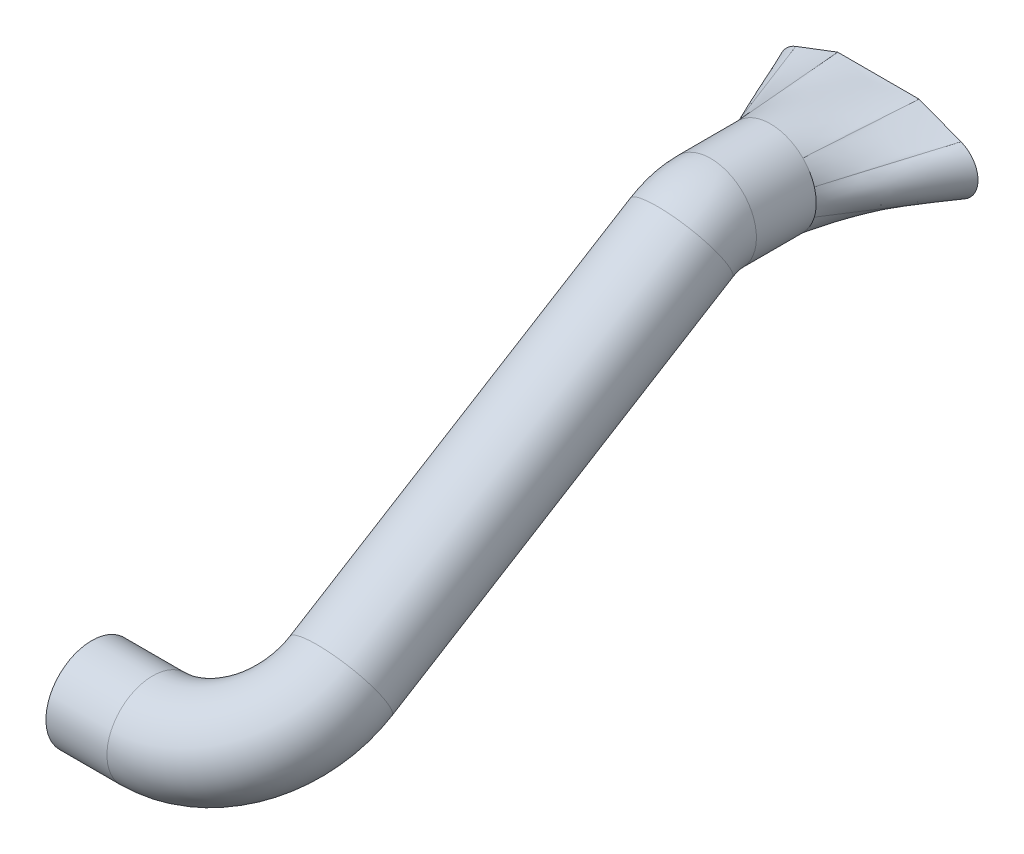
SolidWorks part; units mm, degrees
ref_plane "Face" through (0, 0, 0) normal (0, 0, 1) x (1, 0, 0)
ref_plane "Dessus" through (0, 0, 0) normal (0, 1, 0) x (1, 0, 0)
ref_plane "Droite" through (0, 0, 0) normal (1, 0, 0) x (0, 0, -1)
sketch "Esquisse1" plane through (0, 0, 0) normal (0, 0, 1) x (1, 0, 0)
  line L6 (-46.6245, 21.8504) -> (-26, 14)
  line L7 (-26, 14) -> (14, 14)
  line L8 (14, 14) -> (34.6245, 21.8504)
  line L9 (34.6245, 46.1496) -> (14, 54)
  line L10 (14, 54) -> (-26, 54)
  line L11 (-26, 54) -> (-46.6245, 46.1496)
  line L12 (-46.6245, 21.8504) -> (-26, 14)
  line L13 (-26, 14) -> (14, 14)
  line L14 (14, 14) -> (34.6245, 21.8504)
  line L15 (34.6245, 46.1496) -> (14, 54)
  line L16 (14, 54) -> (-26, 54)
  line L17 (-26, 54) -> (-46.6245, 46.1496)
  arc A2 (34.6245, 21.8504) -> (34.6245, 46.1496) centre (30, 34) ccw
  arc A3 (-46.6245, 46.1496) -> (-46.6245, 21.8504) centre (-42, 34) ccw
  arc A4 (34.6245, 21.8504) -> (34.6245, 46.1496) centre (30, 34) ccw
  arc A5 (-46.6245, 46.1496) -> (-46.6245, 21.8504) centre (-42, 34) ccw
  dimension "D1" = 0
ref_plane "Plan1" through (0, 0, 50) normal (0, 0, 1) x (1, 0, 0)
sketch "Esquisse2" plane through (0, 0, 50) normal (0, 0, 1) x (1, 0, 0)
  line L0 (36.7996, 34.4495) -> (25.4008, 34.4495) construction
  circle A0 centre (-9.0342, 34.4495) radius 22.5
  dimension "D1" = 45
loft "Base-Lissage" add profiles "Esquisse1", "Esquisse2"
ref_plane "Plan2" through (-8, 0, 0) normal (1, 0, 0) x (0, 0, -1)
sketch "Esquisse3" plane through (-8, 0, 0) normal (1, 0, 0) x (0, 0, -1)
  line L0 (-50, 36.9848) -> (-79.4263, 36.9848)
  line L1 (-50, 40.8965) -> (-50, 28.0025) construction
  line L2 (-95.1364, 32.5424) -> (-258.2936, -67.7494)
  line L5 (56.5732, -138.5533) -> (23.0136, -159.1822) construction
  arc A0 (-95.1364, 32.5424) -> (-79.4263, 36.9848) centre (-79.4263, 6.9848) cw
  point P9 (-87.9095, 36.9848)
  dimension "D2" = 30
  dimension "D1" = 200
sketch "Esquisse4" plane through (0, 0, 50) normal (0, 0, 1) x (1, 0, 0)
  arc A8 (-24.9441, 50.3594) -> (-30.5908, 40.8965) centre (-9.0342, 34.4495) ccw
  arc A9 (-30.5908, 40.8965) -> (-30.5908, 28.0025) centre (-9.0342, 34.4495) ccw
  arc A10 (-30.5908, 28.0025) -> (-24.9441, 18.5396) centre (-9.0342, 34.4495) ccw
  arc A11 (-24.9441, 18.5396) -> (6.8757, 18.5396) centre (-9.0342, 34.4495) ccw
  arc A12 (6.8757, 18.5396) -> (12.5224, 28.0025) centre (-9.0342, 34.4495) ccw
  arc A13 (12.5224, 28.0025) -> (12.5224, 40.8965) centre (-9.0342, 34.4495) ccw
  arc A14 (12.5224, 40.8965) -> (6.8757, 50.3594) centre (-9.0342, 34.4495) ccw
  arc A15 (6.8757, 50.3594) -> (-24.9441, 50.3594) centre (-9.0342, 34.4495) ccw
  arc A16 (-24.9441, 50.3594) -> (-30.5908, 40.8965) centre (-9.0342, 34.4495) ccw
  arc A17 (-30.5908, 40.8965) -> (-30.5908, 28.0025) centre (-9.0342, 34.4495) ccw
  arc A18 (-30.5908, 28.0025) -> (-24.9441, 18.5396) centre (-9.0342, 34.4495) ccw
  arc A19 (-24.9441, 18.5396) -> (6.8757, 18.5396) centre (-9.0342, 34.4495) ccw
  arc A20 (6.8757, 18.5396) -> (12.5224, 28.0025) centre (-9.0342, 34.4495) ccw
  arc A21 (12.5224, 28.0025) -> (12.5224, 40.8965) centre (-9.0342, 34.4495) ccw
  arc A22 (12.5224, 40.8965) -> (6.8757, 50.3594) centre (-9.0342, 34.4495) ccw
  arc A23 (6.8757, 50.3594) -> (-24.9441, 50.3594) centre (-9.0342, 34.4495) ccw
  dimension "D1" = 0
sweep "Boss.-Balayage1" add profiles "Esquisse4" path "Esquisse3"
sketch "Esquisse5" plane through (0, -133.8105, 217.6862) normal (0, -0.5237, 0.8519) x (1, 0, 0)
  circle A1 centre (-9.0342, 75.0085) radius 22.5
  circle A2 centre (-9.0342, 75.0085) radius 22.5
  dimension "D1" = 0
sketch "Esquisse6" plane through (0, 65.8857, 40.4996) normal (0, 0.8519, 0.5237) x (-1, 0, 0)
  line L0 (9.0342, 255.524) -> (9.0342, 260.524)
  line L1 (59.0342, 310.524) -> (89.0342, 310.524)
  line L2 (31.5342, 255.524) -> (-13.4658, 255.524) construction
  arc A0 (9.0342, 260.524) -> (59.0342, 310.524) centre (59.0342, 260.524) cw
  dimension "D1" = 50
  dimension "D2" = 5
  dimension "D3" = 30
sweep "Boss.-Balayage2" add profiles "Esquisse5" path "Esquisse6"
